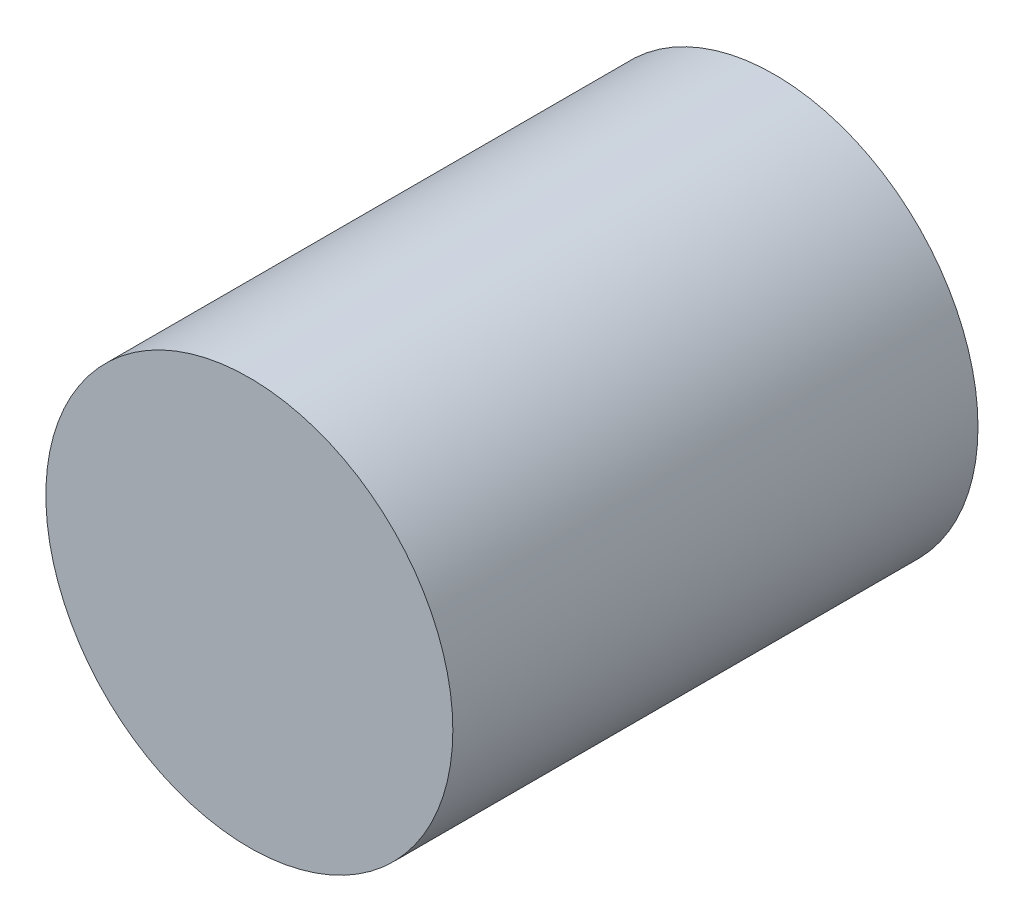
SolidWorks part; units mm, degrees
ref_plane "Plan1" through (0, 0, 0) normal (0, 0, 1) x (1, 0, 0)
ref_plane "Plan2" through (0, 0, 0) normal (0, 1, 0) x (1, 0, 0)
ref_plane "Plan3" through (0, 0, 0) normal (1, 0, 0) x (0, 0, -1)
sketch "Esquisse1" plane through (0, 0, 0) normal (0, 0, 1) x (1, 0, 0)
  circle A0 centre (0, 0) radius 7.75
  dimension "D1" = 15.5
extrude "Base-Extrusion" add sketch "Esquisse1" along normal mid plane 20
